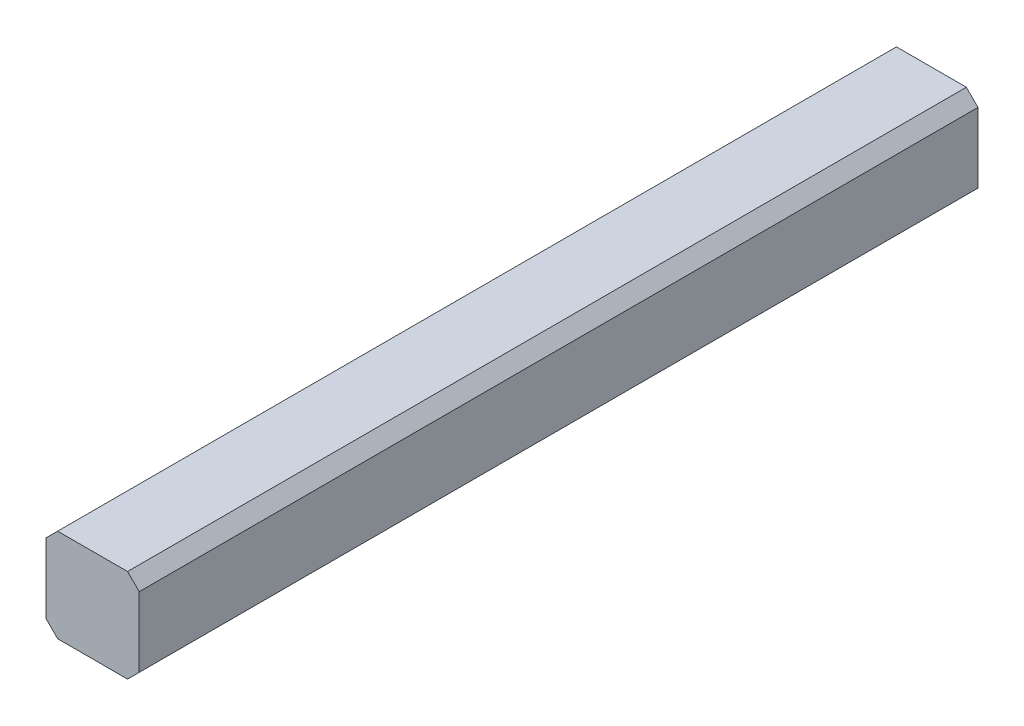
SolidWorks part; units mm, degrees
ref_plane "Front" through (0, 0, 0) normal (0, 0, 1) x (1, 0, 0)
ref_plane "Top" through (0, 0, 0) normal (0, 1, 0) x (1, 0, 0)
ref_plane "Right" through (0, 0, 0) normal (1, 0, 0) x (0, 0, -1)
other "Configuration Table"
sketch "body" plane through (0, 0, 0) normal (0, 0, 1) x (1, 0, 0)
  line L1 (0, 0) -> (2, 0)
  line L2 (0, 0) -> (0, 2)
  line L3 (0, 2) -> (2, 2)
  line L4 (2, 0) -> (2, 2)
  dimension "Width" = 2
  dimension "Thickness" = 2
extrude "Extrude1" add sketch "body" along normal blind 18
chamfer "Chamfer1" distance 0.25 4 edges at (0, 0, 9) (2, 0, 9) (2, 2, 9) (0, 2, 9)
